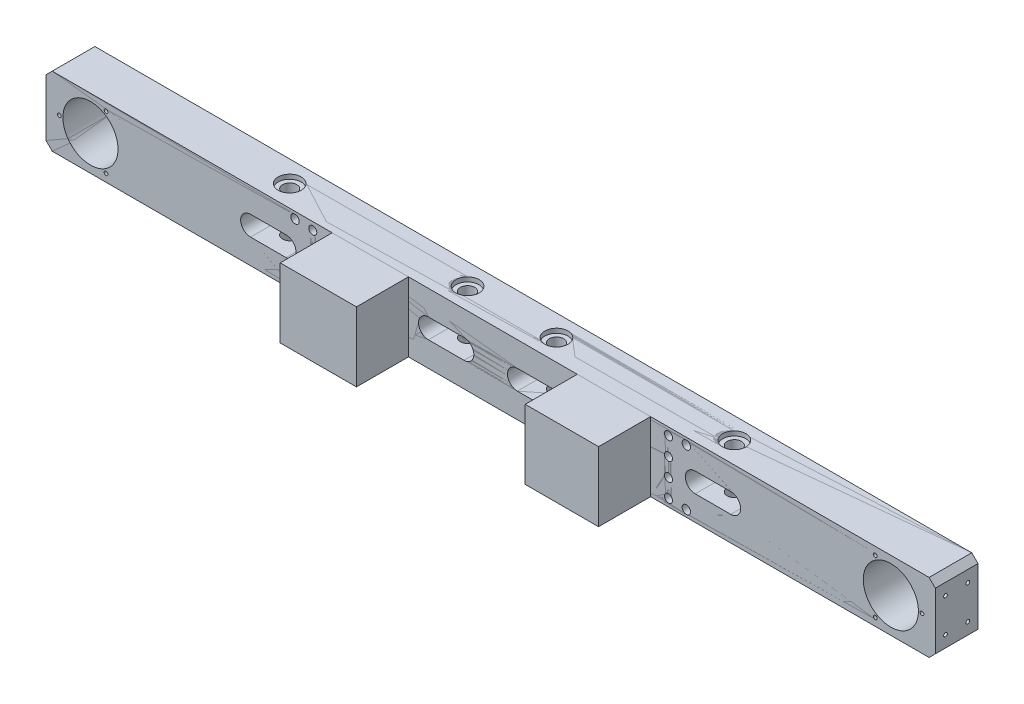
SolidWorks part; units mm, degrees
ref_plane "Face" through (0, 0, 0) normal (0, 0, 1) x (1, 0, 0)
ref_plane "Dessus" through (0, 0, 0) normal (0, 1, 0) x (1, 0, 0)
ref_plane "Droite" through (0, 0, 0) normal (1, 0, 0) x (0, 0, -1)
imported_body "Importée1"
sketch "Esquisse1" plane through (0, 0, 0) normal (0, 0, 1) x (1, 0, 0)
  line L0 (442, 86) -> (-544, 86) construction
  line L1 (-229.161, 86) -> (-143.4301, 86)
  line L2 (-229.161, 86) -> (-229.161, 8)
  line L3 (-229.161, 8) -> (-143.4301, 8)
  line L4 (-143.4301, 86) -> (-143.4301, 8)
  line L5 (-544, 8) -> (442, 8) construction
extrude "Extrusion1" add sketch "Esquisse1" along normal blind 58.5
sketch "Esquisse2" plane through (0, 0, 0) normal (0, 0, 1) x (1, 0, 0)
  line L0 (442, 86) -> (-143.4301, 86) construction
  line L1 (46.3769, 86) -> (128.8255, 86)
  line L2 (46.3769, 86) -> (46.3769, 8)
  line L3 (46.3769, 8) -> (128.8255, 8)
  line L4 (128.8255, 86) -> (128.8255, 8)
extrude "Extrusion2" add sketch "Esquisse2" along normal blind 58.5
ref_plane "Plan2" through (0, 47.8, 0) normal (0, 1, 0) x (-1, 0, 0)
sketch "Esquisse4" plane through (0, 47.8, 0) normal (0, 1, 0) x (-1, 0, 0)
  circle A1 centre (1, -24) radius 8 construction
  point P0 (1, -24)
ref_plane "Plan3" through (0, 47.7, 0) normal (0, 1, 0) x (-1, 0, 0)
sketch "Esquisse5" plane through (0, 47.7, 0) normal (0, 1, 0) x (-1, 0, 0)
  circle A0 centre (101, -24) radius 8 construction
  point P0 (101, -24)
